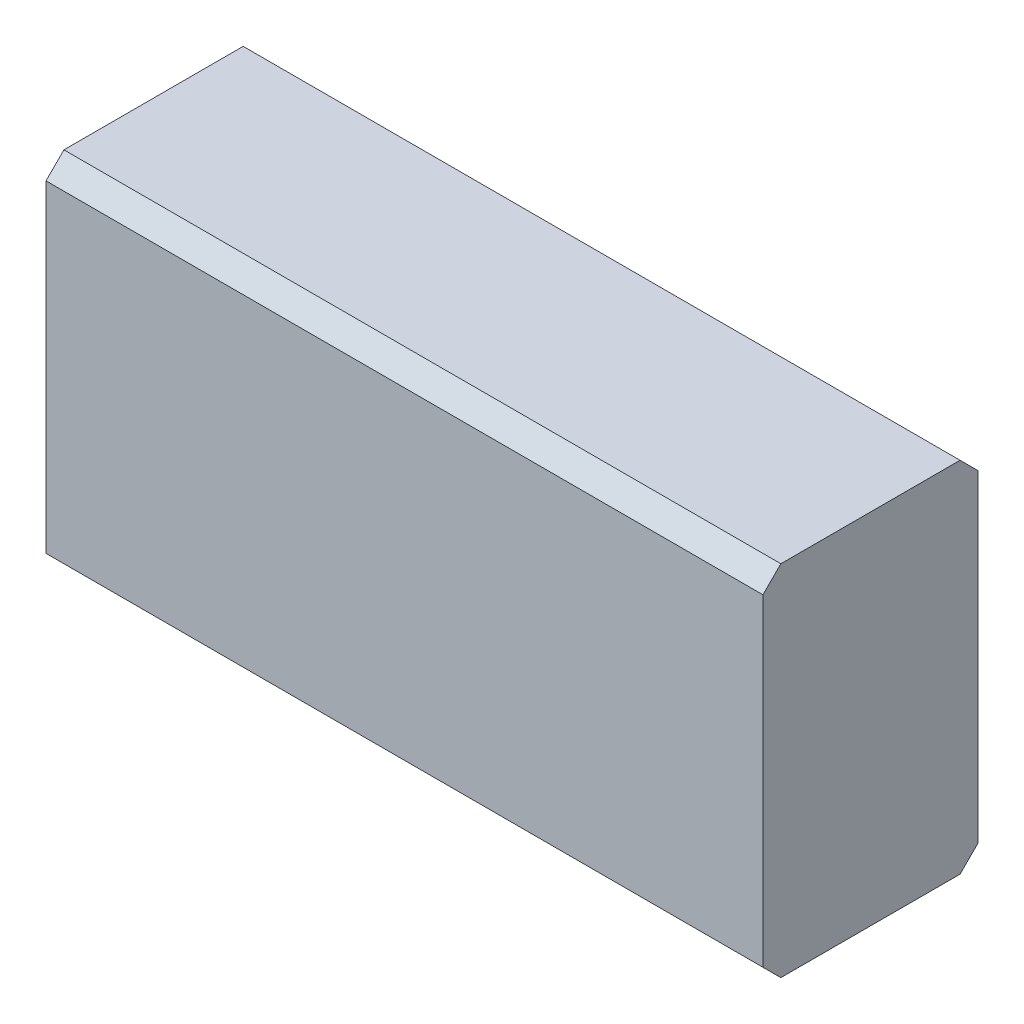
SolidWorks part; units mm, degrees
ref_plane "Front" through (0, 0, 0) normal (0, 0, 1) x (1, 0, 0)
ref_plane "Top" through (0, 0, 0) normal (0, 1, 0) x (1, 0, 0)
ref_plane "Right" through (0, 0, 0) normal (1, 0, 0) x (0, 0, -1)
other "Configuration Table"
sketch "Sketch1" plane through (0, 0, 0) normal (0, 0, 1) x (1, 0, 0)
  line L0 (0, 2.5) -> (-5, 2.5)
  line L1 (-5, -2.5) -> (0, -2.5)
  arc A0 (-5, 2.5) -> (-5, -2.5) centre (-5, 0) ccw
  arc A1 (0, -2.5) -> (0, 2.5) centre (0, 0) ccw
  dimension "b" = 5
  dimension "l" = 10
extrude "Extrude1" add sketch "Sketch1" along normal blind 3
sketch "Sketch2" plane through (0, 0, 0) normal (0, 0, 1) x (1, 0, 0)
  line L0 (0, 2.5) -> (-5, 2.5) construction
  line L1 (-7.5, 2.5) -> (2.5, 2.5)
  line L2 (-7.5, 2.5) -> (-7.5, -2.5)
  line L3 (-7.5, -2.5) -> (2.5, -2.5)
  line L4 (2.5, 2.5) -> (2.5, -2.5)
  line L5 (-5, -2.5) -> (0, -2.5) construction
  arc A0 (-5, 2.5) -> (-5, -2.5) centre (-5, 0) ccw construction
  arc A1 (0, -2.5) -> (0, 2.5) centre (0, 0) ccw construction
extrude "Extrude2" add sketch "Sketch2" along normal blind 3
sketch "Sketch3" plane through (0, 0, 0) normal (0, 0, 1) x (1, 0, 0)
  line L0 (-5, -2.5) -> (0, -2.5) construction
  line L1 (-5, -2.5) -> (2.5, -2.5)
  line L3 (-5, 2.5) -> (2.5, 2.5)
  line L4 (2.5, -2.5) -> (2.5, 2.5)
  arc A1 (-5, 2.5) -> (-5, -2.5) centre (-5, 0) ccw
  arc A2 (0, -2.5) -> (0, 2.5) centre (0, 0) ccw construction
  arc A3 (-5, 2.5) -> (-5, -2.5) centre (-5, 0) ccw construction
extrude "Extrude3" add sketch "Sketch3" along normal blind 3
chamfer "Chamfer1" distance 0.25 angle 45 8 edges at (-2.5, 2.5, 0) (-2.5, -2.5, 0) (-2.5, 2.5, 3) (-2.5, -2.5, 3) (2.5, 0, 0) (-7.5, 0, 0) (-7.5, 0, 3) (2.5, 0, 3)
equation "\"D1@Extrude2\" = \"h@Extrude1\""
equation "\"D1@Extrude3\" = \"h@Extrude1\""
